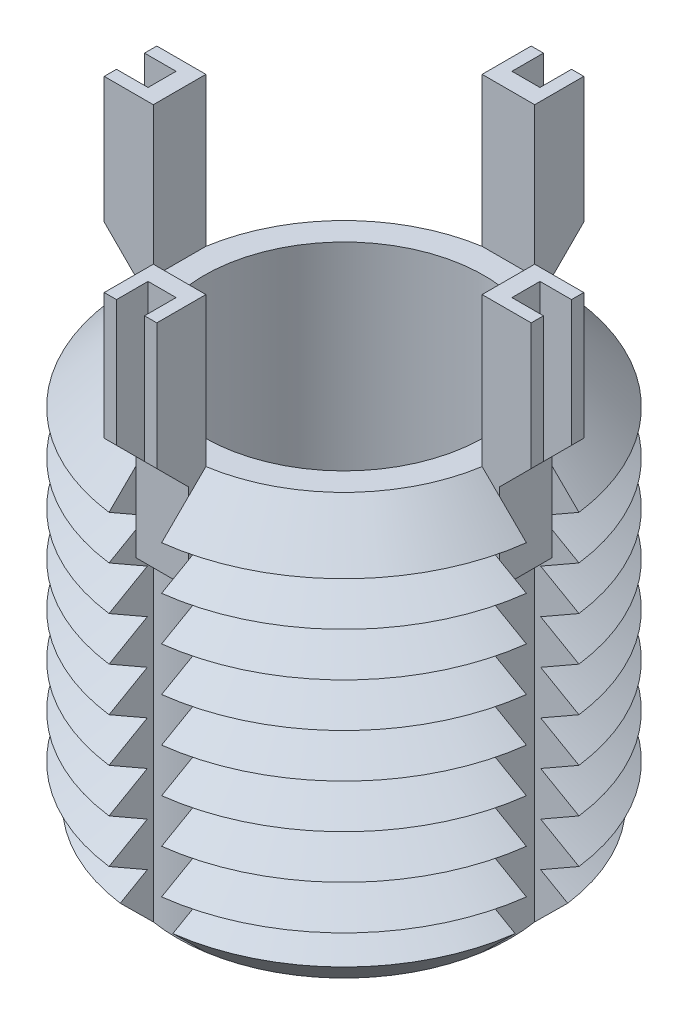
SolidWorks part; units mm, degrees
ref_plane "Front Plane" through (0, 0, 0) normal (0, 0, 1) x (1, 0, 0)
ref_plane "Top Plane" through (0, 0, 0) normal (0, 1, 0) x (1, 0, 0)
ref_plane "Right Plane" through (0, 0, 0) normal (1, 0, 0) x (0, 0, -1)
sketch "Sketch1" plane through (0, 0, 0) normal (0, 1, 0) x (1, 0, 0)
  circle A0 centre (0, 0) radius 6
  dimension "D1" = 12
extrude "Boss-Extrude1" add sketch "Sketch1" against normal blind 12
chamfer "Chamfer1" distance 1.25 angle 45 2 edges at (0, -12, 6) (0, 0, 6)
sketch "Sketch2" plane through (0, 0, 0) normal (1, 0, 0) x (0, 0, -1)
  line L0 (0, 0.8859) -> (0, -9.2617) construction
sketch "Sketch3" plane through (0, 0, 0) normal (1, 0, 0) x (0, 0, -1)
  line L0 (-6, -1.25) -> (-4.9175, -1.875)
  line L1 (-4.9175, -1.875) -> (-6, -2.5)
  line L2 (-6, -1.25) -> (-6, -10.75) construction
  line L3 (-6, -2.5) -> (-6, -1.25)
  dimension "D1" = 1.25
revolve "Cut-Revolve1" cut sketch "Sketch3" angle 360 about L0
pattern_linear "LPattern1" count 8 spacing 1.25 along (0, -1, 0) of "Cut-Revolve1"
sketch "Sketch4" plane through (0, 0, 0) normal (0, 1, 0) x (1, 0, 0)
  line L0 (-4.6904, 0.75) -> (-5.9529, 0.75)
  line L2 (-5.9529, -0.75) -> (-4.6904, -0.75)
  arc A0 (-4.6904, 0.75) -> (-4.6904, -0.75) centre (0, 0) ccw
  arc A1 (-5.9529, 0.75) -> (-5.9529, -0.75) centre (0, 0) ccw
  circle A2 centre (0, 0) radius 6 construction
  circle A3 centre (0, 0) radius 4.75 construction
  point P1 (-4.75, 0)
  point P3 (-6, 0)
  point P13 (0, 0)
  dimension "D1" = 1.5
extrude "Cut-Extrude1" cut sketch "Sketch4" against normal up to surface (12 mm away)
pattern_circular "CirPattern1" count 4 over 360 about axis through (0, 0, 0) along (0, 1, 0) of "Cut-Extrude1"
sketch "Sketch5" plane through (0, 0, 0) normal (1, 0, 0) x (0, 0, -1)
  line L0 (-4.6904, 4.25) -> (-4.6904, -2.75)
  line L1 (-4.6904, -2.75) -> (-5.1904, -2.75)
  line L2 (-5.1904, -2.75) -> (-5.1904, -0.25)
  line L3 (-5.1904, -0.25) -> (-6.0904, 0.65)
  line L4 (-6.0904, 0.65) -> (-6.0904, 4.25)
  line L5 (-6.0904, 4.25) -> (-4.6904, 4.25)
  line L6 (-5.9529, -3.75) -> (-0.75, -3.75) construction
  point P9 (-0.75, 0)
  point P10 (-5.1904, -0.25)
  dimension "D1" = 1
  dimension "D2" = 7
  dimension "D3" = 4.5
  dimension "D4" = 1.4
  dimension "D5" = 0.5
  dimension "D6" = 45
extrude "Boss-Extrude3" add sketch "Sketch5" along normal mid plane 1.5
pattern_circular "CirPattern2" count 4 over 360 about axis through (0, 0, 0) along (0, 1, 0) of "Boss-Extrude3"
sketch "Sketch6" plane through (0, 4.25, 0) normal (0, 1, 0) x (1, 0, 0)
  line L0 (-6.0904, -0.75) -> (-6.0904, 0.75) construction
  line L1 (-6.0904, -0.4) -> (-5.1904, -0.4)
  line L2 (-6.0904, -0.4) -> (-6.0904, 0.4)
  line L3 (-6.0904, 0.4) -> (-5.1904, 0.4)
  line L4 (-5.1904, -0.4) -> (-5.1904, 0.4)
  line L5 (-6.0904, -0.4) -> (-5.1904, 0.4) construction
  line L6 (-6.0904, 0.4) -> (-5.1904, -0.4) construction
  line L7 (6.0904, 0.75) -> (6.0904, -0.75) construction
  line L8 (-0.4, 5.1904) -> (0.4, 5.1904)
  line L9 (-0.4, 5.1904) -> (-0.4, 6.0904)
  line L10 (-0.4, 6.0904) -> (0.4, 6.0904)
  line L11 (0.4, 5.1904) -> (0.4, 6.0904)
  line L12 (-0.4, 5.1904) -> (0.4, 6.0904) construction
  line L13 (-0.4, 6.0904) -> (0.4, 5.1904) construction
  line L14 (5.1904, -0.4) -> (6.0904, -0.4)
  line L15 (5.1904, -0.4) -> (5.1904, 0.4)
  line L16 (5.1904, 0.4) -> (6.0904, 0.4)
  line L17 (6.0904, -0.4) -> (6.0904, 0.4)
  line L18 (5.1904, -0.4) -> (6.0904, 0.4) construction
  line L19 (5.1904, 0.4) -> (6.0904, -0.4) construction
  line L20 (-0.4, -6.0904) -> (0.4, -6.0904)
  line L21 (-0.4, -6.0904) -> (-0.4, -5.1904)
  line L22 (-0.4, -5.1904) -> (0.4, -5.1904)
  line L23 (0.4, -6.0904) -> (0.4, -5.1904)
  line L24 (-0.4, -6.0904) -> (0.4, -5.1904) construction
  line L25 (-0.4, -5.1904) -> (0.4, -6.0904) construction
  line L26 (-0.75, 6.0904) -> (0.75, 6.0904) construction
  line L27 (0.75, -6.0904) -> (-0.75, -6.0904) construction
  point P0 (-5.6404, 0)
  point P7 (-6.0904, 0)
  point P8 (-6.0904, 0)
  point P9 (0, 5.6404)
  point P14 (5.6404, 0)
  point P19 (0, -5.6404)
  point P24 (0, 6.0904)
  point P25 (6.0904, 0)
  point P26 (6.0904, 0)
  point P27 (0, 6.0904)
  point P30 (0, -6.0904)
  point P33 (0, -6.0904)
  dimension "D1" = 0.8
  dimension "D2" = 0.9
extrude "Cut-Extrude3" cut sketch "Sketch6" against normal through all both and the other way through all
sketch "Sketch7" plane through (0, 0, 0) normal (0, 1, 0) x (1, 0, 0)
  circle A0 centre (0, 0) radius 4
  dimension "D1" = 8
extrude "Cut-Extrude4" cut sketch "Sketch7" against normal up to surface (12 mm away)
